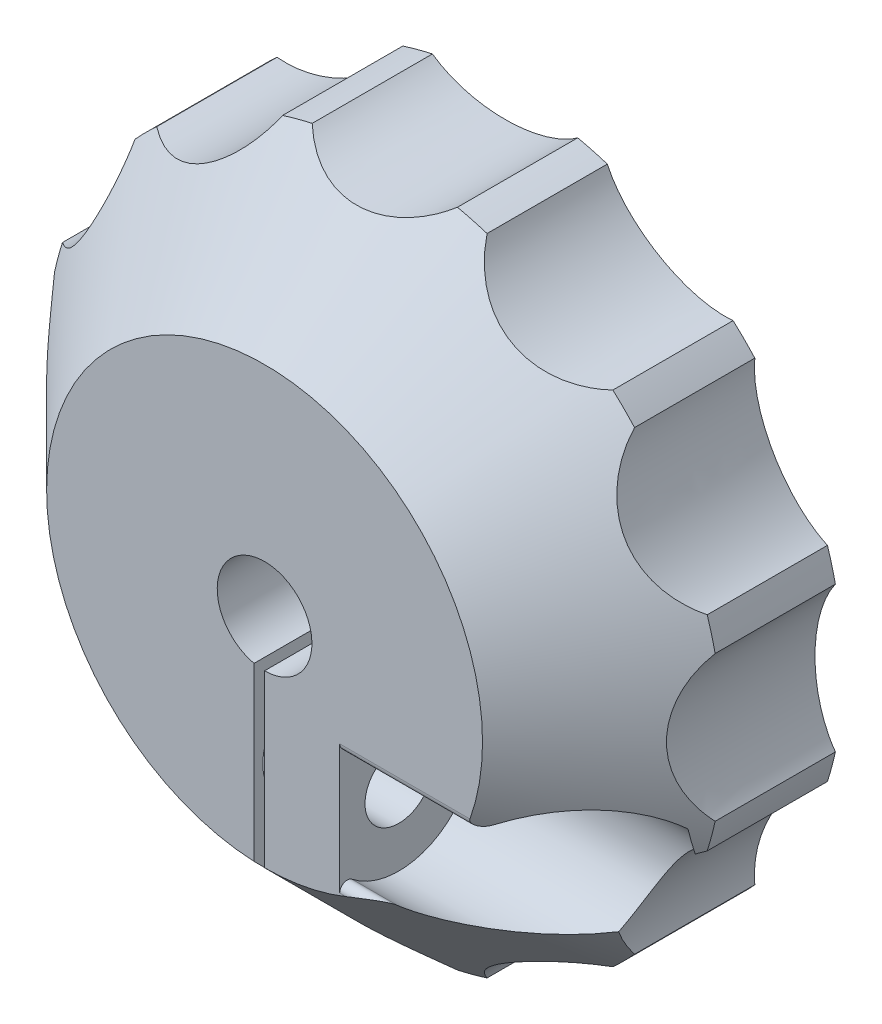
SolidWorks part; units mm, degrees
ref_plane "Plan de face" through (0, 0, 0) normal (0, 0, 1) x (1, 0, 0)
ref_plane "Plan de dessus" through (0, 0, 0) normal (0, 1, 0) x (1, 0, 0)
ref_plane "Plan de droite" through (0, 0, 0) normal (1, 0, 0) x (0, 0, -1)
sketch "Esquisse1" plane through (0, 0, 0) normal (0, 0, 1) x (1, 0, 0)
  circle A0 centre (0, 0) radius 3.15
  circle A1 centre (0, 0) radius 22.5
  dimension "D1" = 45
  dimension "D2" = 6.3
extrude "Boss.-Extru.1" add sketch "Esquisse1" along normal blind 16
chamfer "Chanfrein1" distance 8 angle 45 1 edges at (22.5, 0, 16)
sketch "Esquisse2" plane through (0, 0, 16) normal (0, 0, 1) x (1, 0, 0)
  circle A0 centre (0, 0) radius 12.8862
  circle A1 centre (0, 0) radius 4.9
extrude "Boss.-Extru.2" add sketch "Esquisse2" against normal up to surface (16 mm away)
sketch "Esquisse3" plane through (0, 0, 0) normal (1, 0, 0) x (0, 0, -1)
  circle A0 centre (-12.0688, -9.1548) radius 2.25
extrude "Enlèv. mat.-Extru.1" cut sketch "Esquisse3" against normal through all and the other way through all
sketch "Esquisse4" plane through (0, 0, 16) normal (0, 0, 1) x (1, 0, 0)
  line L1 (-0.7015, -2.2594) -> (0, -2.2594)
  line L2 (-0.7015, -2.2594) -> (-0.7015, -24.3075)
  line L3 (-0.7015, -24.3075) -> (0, -24.3075)
  line L4 (0, -2.2594) -> (0, -24.3075)
extrude "Enlèv. mat.-Extru.2" cut sketch "Esquisse4" against normal through all
sketch "Esquisse5" plane through (0, 0, 16) normal (0, 0, 1) x (1, 0, 0)
  ellipse E0 centre (0, 24.3755) end of major axis (6.281, 24.3755) minor radius 3.7579
extrude "Enlèv. mat.-Extru.3" cut sketch "Esquisse5" against normal through all
pattern_circular "Répétition circulaire1" count 12 over 360 about axis through (0, 0, 16) along (0, 0, -1) of "Enlèv. mat.-Extru.3"
sketch "Esquisse6" plane through (0, 0, 0) normal (1, 0, 0) x (0, 0, -1)
  circle A0 centre (-12.0688, -9.1548) radius 5
extrude "Enlèv. mat.-Extru.4" cut sketch "Esquisse6" along normal blind 16 from offset 5
sketch "Esquisse7" plane through (-0.7015, 0, 0) normal (1, 0, 0) x (0, 0, -1)
  circle A0 centre (-12.0688, -9.1548) radius 3.35
extrude "Enlèv. mat.-Extru.5" cut sketch "Esquisse7" against normal through all draft 0.5 contours A0
fillet "Congé1" radius 0.5 2 edges at (9.0853, -6.0652, 16) (6.3835, -12.2443, 16)
